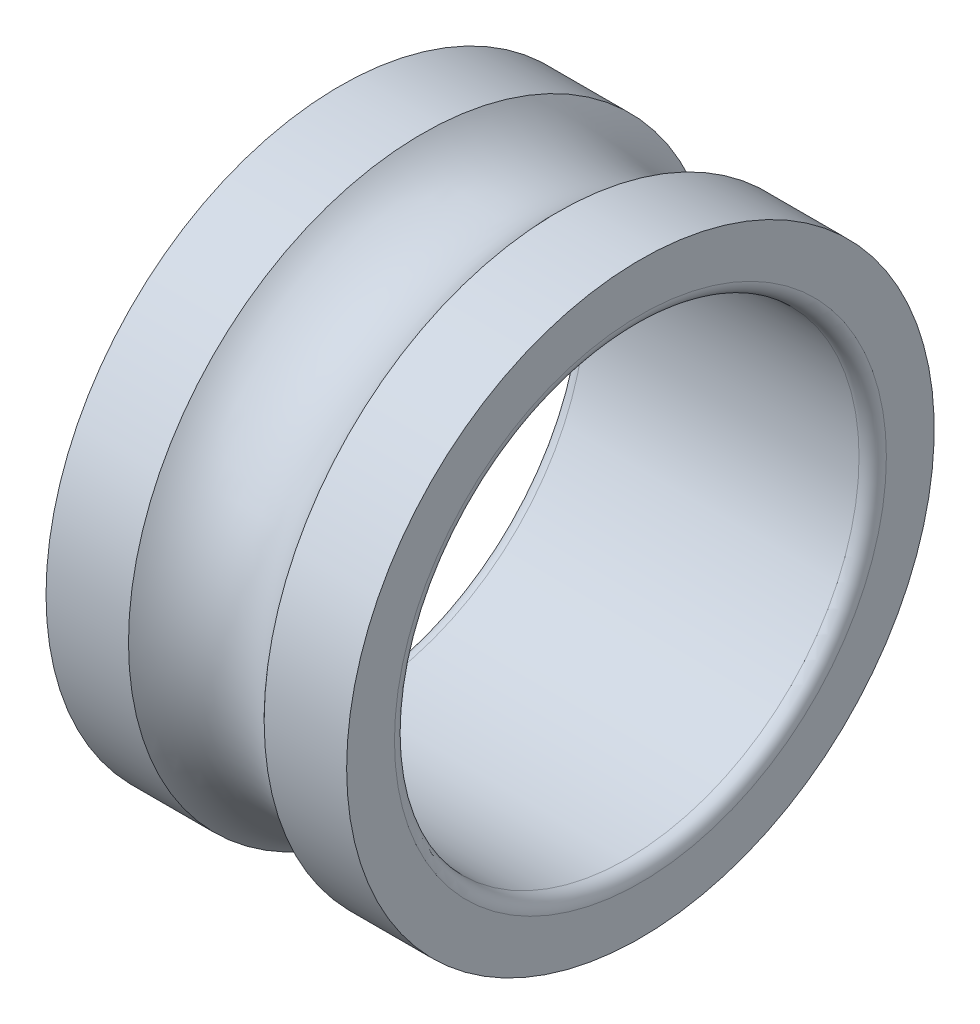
SolidWorks part; units mm, degrees
ref_plane "Plan 1" through (0, 0, 0) normal (0, 0, 1) x (1, 0, 0)
ref_plane "Plan 2" through (0, 0, 0) normal (0, 1, 0) x (1, 0, 0)
ref_plane "Plan 3" through (0, 0, 0) normal (1, 0, 0) x (0, 0, -1)
imported_body "Importée1"
sketch "Esquisse1" plane through (11, 0, 0) normal (1, 0, 0) x (0, 0, -1)
  circle A0 centre (0, 0) radius 8.5
  dimension "D1" = 17
extrude "Enlèv. mat.-Extru.1" cut sketch "Esquisse1" against normal through all
fillet "Congé1" radius 0.5
